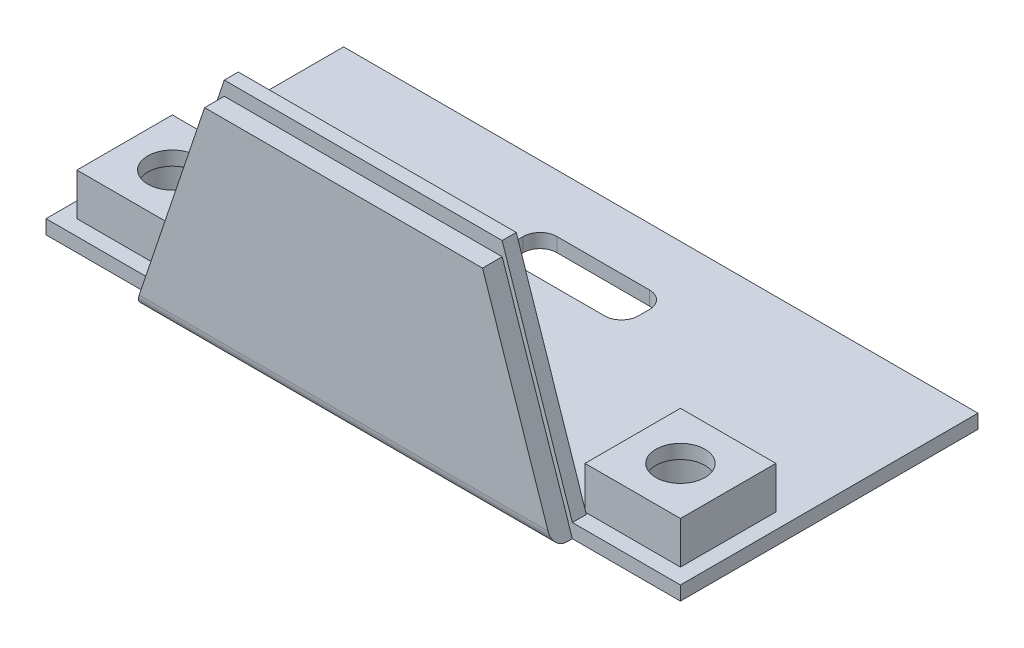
SolidWorks part; units mm, degrees
ref_plane "Ebene vorne" through (0, 0, 0) normal (0, 0, 1) x (1, 0, 0)
ref_plane "Ebene oben" through (0, 0, 0) normal (0, 1, 0) x (1, 0, 0)
ref_plane "Ebene rechts" through (0, 0, 0) normal (1, 0, 0) x (0, 0, -1)
sketch "Skizze1" plane through (0, 0, 0) normal (0, 1, 0) x (1, 0, 0)
  line L1 (22.6, -10.6) -> (-22.6, -10.6)
  line L2 (22.6, -10.6) -> (22.6, 10.6)
  line L3 (22.6, 10.6) -> (-22.6, 10.6)
  line L4 (-22.6, -10.6) -> (-22.6, 10.6)
  line L5 (22.6, -10.6) -> (-22.6, 10.6) construction
  line L6 (22.6, 10.6) -> (-22.6, -10.6) construction
  point P0 (0, 0)
  dimension "D1" = 21.2
  dimension "D2" = 45.2
extrude "Aufsatz-Linear austragen1" add sketch "Skizze1" along normal blind 1
sketch "Skizze2" plane through (0, 0, 10.6) normal (0, 0, 1) x (1, 0, 0)
  line L0 (0, 0) -> (0, 14.9) construction
  line L1 (9.9, 14.9) -> (-9.9, 14.9)
  line L2 (-9.9, 14.9) -> (-14.9, 0)
  line L3 (-22.6, 0) -> (22.6, 0) construction
  line L4 (-14.9, 0) -> (14.9, 0)
  line L5 (9.9, 14.9) -> (14.9, 0)
  dimension "D1" = 14.9
  dimension "D2" = 14.9
  dimension "D3" = 9.9
extrude "Aufsatz-Linear austragen2" add sketch "Skizze2" along normal blind 1.4
sketch "Skizze3" plane through (0, 0, 10.6) normal (0, 0, -1) x (-1, 0, 0)
  line L4 (0, 0) -> (0, 20.2624) construction
  line L5 (-22.6, 0) -> (22.6, 0) construction
  line L6 (-9.9, 14.9) -> (9.9, 14.9) construction
  line L8 (-9.9, 14.9) -> (9.9, 14.9) construction
  line L9 (9.9, 14.9) -> (14.5644, 1) construction
  line L10 (-14.5644, 1) -> (14.5644, 1)
  line L11 (-22.6, 1) -> (22.6, 1) construction
  line L12 (-9.9, 15.9) -> (9.9, 15.9)
  line L13 (9.9, 15.9) -> (14.9, 1)
  line L14 (14.9, 1) -> (14.5644, 1)
  line L15 (9.9, 14.9) -> (9.9, 15.9) construction
  line L16 (-9.9, 14.9) -> (-9.9, 15.9) construction
  line L17 (-9.9, 14.9) -> (-14.5644, 1) construction
  line L18 (-14.9, 1) -> (-14.5644, 1)
  line L19 (-9.9, 15.9) -> (-14.9, 1)
  point P14 (0, 1)
  point P18 (0, 14.9)
  point P19 (0, 15.9)
  point P27 (0, 14.9)
  point P28 (0, 15.9)
  dimension "D1" = 1
extrude "Aufsatz-Linear austragen3" add sketch "Skizze3" along normal blind 1
sketch "Skizze4" plane through (0, 1, 0) normal (0, 1, 0) x (1, 0, 0)
  line L0 (14.9, -10.6) -> (22.6, -10.6) construction
  line L1 (14.7, -2.7) -> (21.5, -2.7)
  line L2 (14.7, -2.7) -> (14.7, -9.5)
  line L3 (14.7, -9.5) -> (21.5, -9.5)
  line L4 (21.5, -2.7) -> (21.5, -9.5)
  line L5 (14.7, -2.7) -> (21.5, -9.5) construction
  line L6 (14.7, -9.5) -> (21.5, -2.7) construction
  line L7 (22.6, -10.6) -> (22.6, 10.6) construction
  circle A0 centre (18.1, -6.1) radius 3 construction
  circle A1 centre (18.1, -6.1) radius 1.75
  point P0 (18.1, -6.1)
  dimension "D3" = 6
  dimension "D6" = 3.5
  dimension "D1" = 1.1
  dimension "D2" = 1.1
  dimension "D4" = 6.8
  dimension "D5" = 6.8
extrude "Aufsatz-Linear austragen4" add sketch "Skizze4" along normal blind 3
sketch "Skizze5" plane through (0, 1, 0) normal (0, 1, 0) x (1, 0, 0)
  circle A0 centre (18.1, -6.1) radius 3
  dimension "D1" = 6
extrude "Schnitt-Linear austragen1" cut sketch "Skizze5" against normal up to surface (1 mm away) and the other way blind 2
mirror "Spiegeln1" about plane through (0, 0, 0) normal (1, 0, 0) of "Aufsatz-Linear austragen4", "Schnitt-Linear austragen1"
sketch "Skizze6" plane through (0, 0, 0) normal (0, -1, 0) x (1, 0, 0)
  line L0 (0, 0) -> (0, -9) construction
  line L1 (22.7, -10.7) -> (-22.7, -10.7) construction
  line L2 (-3.3, -6.5) -> (3.3, -6.5)
  line L3 (-4.5, -5.3) -> (-4.5, -4.5)
  line L4 (-3.3, -3.3) -> (3.3, -3.3)
  line L5 (4.5, -5.3) -> (4.5, -4.5)
  line L6 (-4.5, -6.5) -> (4.5, -3.3) construction
  line L7 (-4.5, -3.3) -> (4.5, -6.5) construction
  arc A0 (-4.5, -4.5) -> (-3.3, -3.3) centre (-3.3, -4.5) cw
  arc A1 (-3.3, -6.5) -> (-4.5, -5.3) centre (-3.3, -5.3) cw
  arc A2 (3.3, -6.5) -> (4.5, -5.3) centre (3.3, -5.3) ccw
  arc A3 (3.3, -3.3) -> (4.5, -4.5) centre (3.3, -4.5) cw
  point P3 (0, -4.9)
  dimension "D4" = 1.2
  dimension "D1" = 9
  dimension "D2" = 3.2
  dimension "D3" = 4.2
extrude "Schnitt-Linear austragen2" cut sketch "Skizze6" against normal up to surface (1 mm away)
fillet "Verrundung1" radius 1 1 edges at (0, 0, 12)
